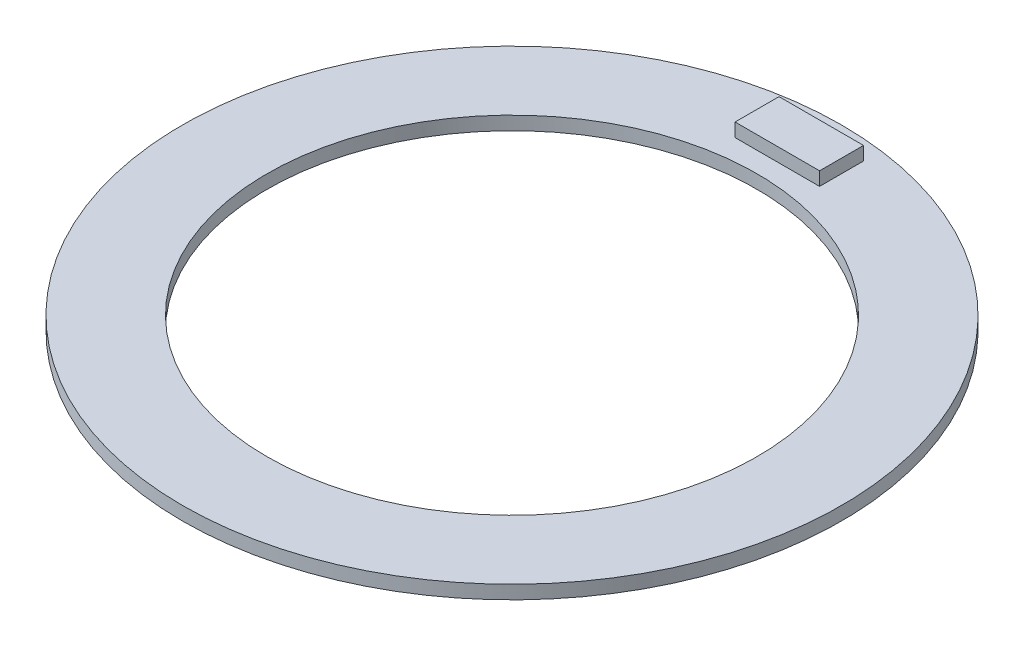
SolidWorks part; units mm, degrees
ref_plane "Front" through (0, 0, 0) normal (0, 0, 1) x (1, 0, 0)
ref_plane "Top" through (0, 0, 0) normal (0, 1, 0) x (1, 0, 0)
ref_plane "Right" through (0, 0, 0) normal (1, 0, 0) x (0, 0, -1)
sketch "Sketch1" plane through (0, 0, 0) normal (0, 1, 0) x (1, 0, 0)
  circle A0 centre (0, 0) radius 24.765
  circle A1 centre (0, 0) radius 18.415
  dimension "D1" = 49.53
  dimension "D2" = 36.83
extrude "Boss-Extrude1" add sketch "Sketch1" along normal blind 1.016
sketch "Sketch2" plane through (0, 1.016, 0) normal (0, 1, 0) x (1, 0, 0)
  line L0 (-3.175, 19.939) -> (3.175, 23.241) construction
  line L1 (-3.175, 23.241) -> (3.175, 23.241)
  line L2 (-3.175, 23.241) -> (-3.175, 19.939)
  line L3 (-3.175, 19.939) -> (3.175, 19.939)
  line L4 (3.175, 23.241) -> (3.175, 19.939)
  line L6 (0, 21.59) -> (0, 18.415) construction
  line L7 (0, 21.59) -> (0, 24.765) construction
  circle A0 centre (0, 0) radius 18.415 construction
  circle A1 centre (0, 0) radius 24.765 construction
  dimension "D1" = 6.35
  dimension "D2" = 3.302
extrude "Boss-Extrude2" add sketch "Sketch2" along normal blind 1.016 separate body
